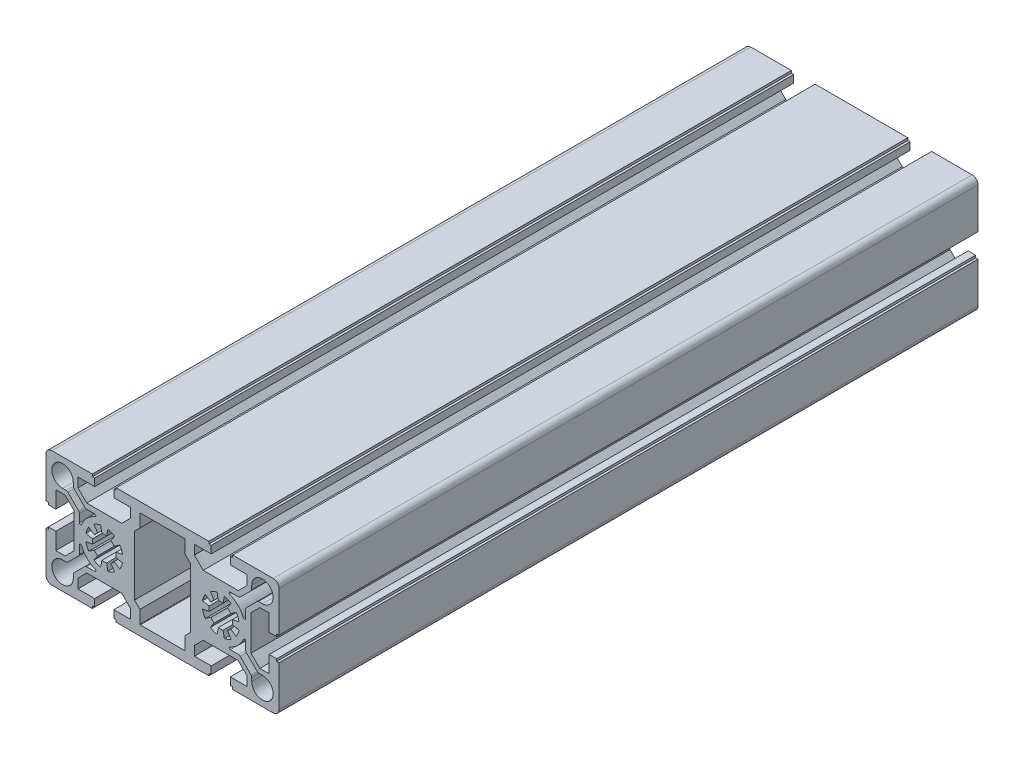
SolidWorks part; units mm, degrees
ref_plane "前视" through (0, 0, 0) normal (0, 0, 1) x (1, 0, 0)
ref_plane "上视" through (0, 0, 0) normal (0, 1, 0) x (1, 0, 0)
ref_plane "右视" through (0, 0, 0) normal (1, 0, 0) x (0, 0, -1)
sketch "Model" plane through (0, 0, 0) normal (0, 0, 1) x (1, 0, 0)
  line L0 (3380.7985, 588.0295) -> (3380.7985, 613.6749)
  line L1 (3380.7985, 613.6749) -> (3378.4985, 615.9749)
  line L2 (3378.4985, 615.9749) -> (3378.4985, 621.4522)
  line L3 (3378.2985, 621.6522) -> (3359.2985, 621.6522)
  line L4 (3359.0985, 621.4522) -> (3359.0985, 615.9749)
  line L5 (3359.0985, 615.9749) -> (3356.7985, 613.6749)
  line L6 (3356.7985, 613.6749) -> (3356.7985, 600.8522)
  line L7 (3356.7985, 600.8522) -> (3356.7985, 588.0295)
  line L8 (3356.7985, 588.0295) -> (3359.0985, 585.7295)
  line L9 (3359.0985, 585.7295) -> (3359.0985, 580.2522)
  line L10 (3359.2985, 580.0522) -> (3378.2985, 580.0522)
  line L11 (3378.4985, 580.2522) -> (3378.4985, 585.7295)
  line L12 (3378.4985, 585.7295) -> (3380.7985, 588.0295)
  line L14 (3330.7913, 585.1939) -> (3335.4567, 589.8593)
  line L15 (3336.1638, 590.1522) -> (3339.6802, 590.1522)
  line L16 (3333.0985, 596.7339) -> (3333.0985, 593.2044)
  line L17 (3332.8056, 592.4973) -> (3328.1533, 587.8451)
  line L18 (3327.4462, 587.5522) -> (3325.8985, 587.5522)
  line L19 (3330.4985, 582.9522) -> (3330.4985, 584.4868)
  line L20 (3339.3539, 607.5039) -> (3340.965, 605.0927)
  line L21 (3339.558, 603.6856) -> (3337.1467, 605.2967)
  line L22 (3335.9522, 602.4129) -> (3338.7964, 601.8471)
  line L23 (3338.7964, 599.8572) -> (3335.9522, 599.2914)
  line L24 (3337.1467, 596.4076) -> (3339.558, 598.0188)
  line L25 (3340.965, 596.6117) -> (3339.3539, 594.2004)
  line L26 (3342.2377, 593.0059) -> (3342.8035, 595.8502)
  line L27 (3344.7934, 595.8502) -> (3345.3592, 593.0059)
  line L28 (3348.243, 594.2004) -> (3346.6319, 596.6117)
  line L29 (3348.0389, 598.0188) -> (3350.4502, 596.4076)
  line L30 (3351.6447, 599.2914) -> (3348.8005, 599.8572)
  line L31 (3348.8005, 601.8471) -> (3351.6447, 602.4129)
  line L32 (3350.4502, 605.2967) -> (3348.0389, 603.6856)
  line L33 (3346.6319, 605.0927) -> (3348.243, 607.5039)
  line L34 (3345.3592, 608.6984) -> (3344.7934, 605.8542)
  line L35 (3342.8035, 605.8542) -> (3342.2377, 608.6984)
  line L36 (3396.6319, 605.0927) -> (3398.243, 607.5039)
  line L37 (3395.3592, 608.6984) -> (3394.7934, 605.8542)
  line L38 (3392.8035, 605.8542) -> (3392.2377, 608.6984)
  line L39 (3389.3539, 607.5039) -> (3390.965, 605.0927)
  line L40 (3389.558, 603.6856) -> (3387.1467, 605.2967)
  line L41 (3385.9522, 602.4129) -> (3388.7964, 601.8471)
  line L42 (3388.7964, 599.8572) -> (3385.9522, 599.2914)
  line L43 (3387.1467, 596.4076) -> (3389.558, 598.0188)
  line L44 (3390.965, 596.6117) -> (3389.3539, 594.2004)
  line L45 (3392.2377, 593.0059) -> (3392.8035, 595.8502)
  line L46 (3394.7934, 595.8502) -> (3395.3592, 593.0059)
  line L47 (3398.243, 594.2004) -> (3396.6319, 596.6117)
  line L48 (3398.0389, 598.0188) -> (3400.4502, 596.4076)
  line L49 (3401.6447, 599.2914) -> (3398.8005, 599.8572)
  line L50 (3398.8005, 601.8471) -> (3401.6447, 602.4129)
  line L51 (3400.4502, 605.2967) -> (3398.0389, 603.6856)
  line L52 (3406.8056, 616.5104) -> (3402.1402, 611.8451)
  line L53 (3401.4331, 611.5522) -> (3397.9167, 611.5522)
  line L54 (3404.4985, 604.9704) -> (3404.4985, 608.4999)
  line L55 (3404.7913, 609.207) -> (3409.4436, 613.8593)
  line L56 (3410.1507, 614.1522) -> (3411.6985, 614.1522)
  line L57 (3407.0985, 618.7522) -> (3407.0985, 617.2175)
  line L58 (3407.0985, 584.4868) -> (3407.0985, 582.9522)
  line L59 (3411.6985, 587.5522) -> (3410.1507, 587.5522)
  line L60 (3409.4436, 587.8451) -> (3404.7913, 592.4973)
  line L61 (3404.4985, 593.2044) -> (3404.4985, 596.7339)
  line L62 (3397.9167, 590.1522) -> (3401.4331, 590.1522)
  line L63 (3402.1402, 589.8593) -> (3406.8056, 585.1939)
  line L64 (3348.8985, 576.8522) -> (3348.8985, 575.8522)
  line L65 (3348.8985, 575.8522) -> (3368.7985, 575.8522)
  line L66 (3368.7985, 575.8522) -> (3388.6985, 575.8522)
  line L67 (3388.6985, 575.8522) -> (3388.6985, 576.8522)
  line L68 (3388.6985, 576.8522) -> (3389.6985, 576.8522)
  line L69 (3389.6985, 576.8522) -> (3389.6985, 580.0522)
  line L70 (3389.6985, 580.0522) -> (3382.4985, 580.0522)
  line L71 (3382.4985, 580.0522) -> (3382.4985, 584.0726)
  line L72 (3382.4985, 584.0726) -> (3386.278, 587.8522)
  line L73 (3386.278, 587.8522) -> (3393.7985, 587.8522)
  line L74 (3393.7985, 587.8522) -> (3401.3189, 587.8522)
  line L75 (3401.3189, 587.8522) -> (3405.0985, 584.0726)
  line L76 (3405.0985, 584.0726) -> (3405.0985, 580.0522)
  line L77 (3405.0985, 580.0522) -> (3397.8985, 580.0522)
  line L78 (3397.8985, 580.0522) -> (3397.8985, 576.8522)
  line L79 (3397.8985, 576.8522) -> (3398.8985, 576.8522)
  line L80 (3398.8985, 576.8522) -> (3398.8985, 575.8522)
  line L81 (3398.8985, 575.8522) -> (3416.2985, 575.8522)
  line L82 (3418.7985, 578.3522) -> (3418.7985, 595.7522)
  line L83 (3418.7985, 595.7522) -> (3417.7985, 595.7522)
  line L84 (3417.7985, 595.7522) -> (3417.7985, 596.7522)
  line L85 (3417.7985, 596.7522) -> (3414.5985, 596.7522)
  line L86 (3414.5985, 596.7522) -> (3414.5985, 589.5522)
  line L87 (3414.5985, 589.5522) -> (3410.5649, 589.5522)
  line L88 (3410.5649, 589.5522) -> (3406.7985, 593.3186)
  line L89 (3406.7985, 593.3186) -> (3406.7985, 600.8522)
  line L90 (3406.7985, 600.8522) -> (3406.7985, 608.3857)
  line L91 (3406.7985, 608.3857) -> (3410.5649, 612.1522)
  line L92 (3410.5649, 612.1522) -> (3414.5985, 612.1522)
  line L93 (3414.5985, 612.1522) -> (3414.5985, 604.9522)
  line L94 (3414.5985, 604.9522) -> (3417.7985, 604.9522)
  line L95 (3417.7985, 604.9522) -> (3417.7985, 605.9522)
  line L96 (3417.7985, 605.9522) -> (3418.7985, 605.9522)
  line L97 (3418.7985, 605.9522) -> (3418.7985, 623.3522)
  line L98 (3416.2985, 625.8522) -> (3398.8985, 625.8522)
  line L99 (3398.8985, 625.8522) -> (3398.8985, 624.8522)
  line L100 (3398.8985, 624.8522) -> (3397.8985, 624.8522)
  line L101 (3397.8985, 624.8522) -> (3397.8985, 621.6522)
  line L102 (3397.8985, 621.6522) -> (3405.0985, 621.6522)
  line L103 (3405.0985, 621.6522) -> (3405.0985, 617.6317)
  line L104 (3405.0985, 617.6317) -> (3401.3189, 613.8522)
  line L105 (3401.3189, 613.8522) -> (3393.7985, 613.8522)
  line L106 (3393.7985, 613.8522) -> (3386.278, 613.8522)
  line L107 (3386.278, 613.8522) -> (3382.4985, 617.6317)
  line L108 (3382.4985, 617.6317) -> (3382.4985, 621.6522)
  line L109 (3382.4985, 621.6522) -> (3389.6985, 621.6522)
  line L110 (3389.6985, 621.6522) -> (3389.6985, 624.8522)
  line L111 (3389.6985, 624.8522) -> (3388.6985, 624.8522)
  line L112 (3388.6985, 624.8522) -> (3388.6985, 625.8522)
  line L113 (3388.6985, 625.8522) -> (3368.7985, 625.8522)
  line L114 (3368.7985, 625.8522) -> (3348.8985, 625.8522)
  line L115 (3348.8985, 625.8522) -> (3348.8985, 624.8522)
  line L116 (3348.8985, 624.8522) -> (3347.8985, 624.8522)
  line L117 (3347.8985, 624.8522) -> (3347.8985, 621.6522)
  line L118 (3347.8985, 621.6522) -> (3355.0985, 621.6522)
  line L119 (3355.0985, 621.6522) -> (3355.0985, 617.6317)
  line L120 (3355.0985, 617.6317) -> (3351.3189, 613.8522)
  line L121 (3351.3189, 613.8522) -> (3343.7985, 613.8522)
  line L122 (3343.7985, 613.8522) -> (3336.278, 613.8522)
  line L123 (3336.278, 613.8522) -> (3332.4985, 617.6317)
  line L124 (3332.4985, 617.6317) -> (3332.4985, 621.6522)
  line L125 (3332.4985, 621.6522) -> (3339.6985, 621.6522)
  line L126 (3339.6985, 621.6522) -> (3339.6985, 624.8522)
  line L127 (3339.6985, 624.8522) -> (3338.6985, 624.8522)
  line L128 (3338.6985, 624.8522) -> (3338.6985, 625.8522)
  line L129 (3338.6985, 625.8522) -> (3321.2985, 625.8522)
  line L130 (3318.7985, 623.3522) -> (3318.7985, 605.9522)
  line L131 (3318.7985, 605.9522) -> (3319.7985, 605.9522)
  line L132 (3319.7985, 605.9522) -> (3319.7985, 604.9522)
  line L133 (3319.7985, 604.9522) -> (3322.9985, 604.9522)
  line L134 (3322.9985, 604.9522) -> (3322.9985, 612.1522)
  line L135 (3322.9985, 612.1522) -> (3327.032, 612.1522)
  line L136 (3327.032, 612.1522) -> (3330.7985, 608.3857)
  line L137 (3330.7985, 608.3857) -> (3330.7985, 600.8522)
  line L138 (3330.7985, 600.8522) -> (3330.7985, 593.3186)
  line L139 (3330.7985, 593.3186) -> (3327.032, 589.5522)
  line L140 (3327.032, 589.5522) -> (3322.9985, 589.5522)
  line L141 (3322.9985, 589.5522) -> (3322.9985, 596.7522)
  line L142 (3322.9985, 596.7522) -> (3319.7985, 596.7522)
  line L143 (3319.7985, 596.7522) -> (3319.7985, 595.7522)
  line L144 (3319.7985, 595.7522) -> (3318.7985, 595.7522)
  line L145 (3318.7985, 595.7522) -> (3318.7985, 578.3522)
  line L146 (3321.2985, 575.8522) -> (3338.6985, 575.8522)
  line L147 (3338.6985, 575.8522) -> (3338.6985, 576.8522)
  line L148 (3338.6985, 576.8522) -> (3339.6985, 576.8522)
  line L149 (3339.6985, 576.8522) -> (3339.6985, 580.0522)
  line L150 (3339.6985, 580.0522) -> (3332.4985, 580.0522)
  line L151 (3332.4985, 580.0522) -> (3332.4985, 584.0726)
  line L152 (3332.4985, 584.0726) -> (3336.278, 587.8522)
  line L153 (3336.278, 587.8522) -> (3343.7985, 587.8522)
  line L154 (3343.7985, 587.8522) -> (3351.3189, 587.8522)
  line L155 (3351.3189, 587.8522) -> (3355.0985, 584.0726)
  line L156 (3355.0985, 584.0726) -> (3355.0985, 580.0522)
  line L157 (3355.0985, 580.0522) -> (3347.8985, 580.0522)
  line L158 (3347.8985, 580.0522) -> (3347.8985, 576.8522)
  line L159 (3347.8985, 576.8522) -> (3348.8985, 576.8522)
  line L160 (3330.4985, 617.2175) -> (3330.4985, 618.7522)
  line L161 (3325.8985, 614.1522) -> (3327.4462, 614.1522)
  line L162 (3328.1533, 613.8593) -> (3332.8056, 609.207)
  line L163 (3333.0985, 608.4999) -> (3333.0985, 604.9704)
  line L164 (3339.6802, 611.5522) -> (3336.1638, 611.5522)
  line L165 (3335.4567, 611.8451) -> (3330.7913, 616.5104)
  arc A0 (3378.4985, 621.4522) -> (3378.2985, 621.6522) centre (3378.2985, 621.4522) ccw
  arc A1 (3359.2985, 621.6522) -> (3359.0985, 621.4522) centre (3359.2985, 621.4522) ccw
  arc A2 (3359.0985, 580.2522) -> (3359.2985, 580.0522) centre (3359.2985, 580.2522) ccw
  arc A3 (3378.2985, 580.0522) -> (3378.4985, 580.2522) centre (3378.2985, 580.2522) ccw
  arc A4 (3330.7913, 585.1939) -> (3330.4985, 584.4868) centre (3331.4985, 584.4868) ccw
  arc A5 (3336.1638, 590.1522) -> (3335.4567, 589.8593) centre (3336.1638, 589.1522) ccw
  arc A6 (3339.6802, 590.1522) -> (3339.8674, 591.1158) centre (3339.6802, 590.6522) ccw
  arc A7 (3334.0621, 596.9211) -> (3339.8674, 591.1158) centre (3343.7985, 600.8522) ccw
  arc A8 (3334.0621, 596.9211) -> (3333.0985, 596.7339) centre (3333.5985, 596.7339) ccw
  arc A9 (3332.8056, 592.4973) -> (3333.0985, 593.2044) centre (3332.0985, 593.2044) ccw
  arc A10 (3327.4462, 587.5522) -> (3328.1533, 587.8451) centre (3327.4462, 588.5522) ccw
  arc A11 (3325.8985, 587.5522) -> (3330.4985, 582.9522) centre (3325.8985, 582.9522) ccw
  arc A12 (3340.965, 605.0927) -> (3339.558, 603.6856) centre (3343.7985, 600.8522) ccw
  arc A13 (3337.1467, 605.2967) -> (3335.9522, 602.4129) centre (3343.7985, 600.8522) ccw
  arc A14 (3338.7964, 601.8471) -> (3338.7964, 599.8572) centre (3343.7985, 600.8522) ccw
  arc A15 (3335.9522, 599.2914) -> (3337.1467, 596.4076) centre (3343.7985, 600.8522) ccw
  arc A16 (3339.558, 598.0188) -> (3340.965, 596.6117) centre (3343.7985, 600.8522) ccw
  arc A17 (3339.3539, 594.2004) -> (3342.2377, 593.0059) centre (3343.7985, 600.8522) ccw
  arc A18 (3342.8035, 595.8502) -> (3344.7934, 595.8502) centre (3343.7985, 600.8522) ccw
  arc A19 (3345.3592, 593.0059) -> (3348.243, 594.2004) centre (3343.7985, 600.8522) ccw
  arc A20 (3346.6319, 596.6117) -> (3348.0389, 598.0188) centre (3343.7985, 600.8522) ccw
  arc A21 (3350.4502, 596.4076) -> (3351.6447, 599.2914) centre (3343.7985, 600.8522) ccw
  arc A22 (3348.8005, 599.8572) -> (3348.8005, 601.8471) centre (3343.7985, 600.8522) ccw
  arc A23 (3351.6447, 602.4129) -> (3350.4502, 605.2967) centre (3343.7985, 600.8522) ccw
  arc A24 (3348.0389, 603.6856) -> (3346.6319, 605.0927) centre (3343.7985, 600.8522) ccw
  arc A25 (3348.243, 607.5039) -> (3345.3592, 608.6984) centre (3343.7985, 600.8522) ccw
  arc A26 (3344.7934, 605.8542) -> (3342.8035, 605.8542) centre (3343.7985, 600.8522) ccw
  arc A27 (3342.2377, 608.6984) -> (3339.3539, 607.5039) centre (3343.7985, 600.8522) ccw
  arc A28 (3398.243, 607.5039) -> (3395.3592, 608.6984) centre (3393.7985, 600.8522) ccw
  arc A29 (3394.7934, 605.8542) -> (3392.8035, 605.8542) centre (3393.7985, 600.8522) ccw
  arc A30 (3392.2377, 608.6984) -> (3389.3539, 607.5039) centre (3393.7985, 600.8522) ccw
  arc A31 (3390.965, 605.0927) -> (3389.558, 603.6856) centre (3393.7985, 600.8522) ccw
  arc A32 (3387.1467, 605.2967) -> (3385.9522, 602.4129) centre (3393.7985, 600.8522) ccw
  arc A33 (3388.7964, 601.8471) -> (3388.7964, 599.8572) centre (3393.7985, 600.8522) ccw
  arc A34 (3385.9522, 599.2914) -> (3387.1467, 596.4076) centre (3393.7985, 600.8522) ccw
  arc A35 (3389.558, 598.0188) -> (3390.965, 596.6117) centre (3393.7985, 600.8522) ccw
  arc A36 (3389.3539, 594.2004) -> (3392.2377, 593.0059) centre (3393.7985, 600.8522) ccw
  arc A37 (3392.8035, 595.8502) -> (3394.7934, 595.8502) centre (3393.7985, 600.8522) ccw
  arc A38 (3395.3592, 593.0059) -> (3398.243, 594.2004) centre (3393.7985, 600.8522) ccw
  arc A39 (3396.6319, 596.6117) -> (3398.0389, 598.0188) centre (3393.7985, 600.8522) ccw
  arc A40 (3400.4502, 596.4076) -> (3401.6447, 599.2914) centre (3393.7985, 600.8522) ccw
  arc A41 (3398.8005, 599.8572) -> (3398.8005, 601.8471) centre (3393.7985, 600.8522) ccw
  arc A42 (3401.6447, 602.4129) -> (3400.4502, 605.2967) centre (3393.7985, 600.8522) ccw
  arc A43 (3398.0389, 603.6856) -> (3396.6319, 605.0927) centre (3393.7985, 600.8522) ccw
  arc A44 (3406.8056, 616.5104) -> (3407.0985, 617.2175) centre (3406.0985, 617.2175) ccw
  arc A45 (3401.4331, 611.5522) -> (3402.1402, 611.8451) centre (3401.4331, 612.5522) ccw
  arc A46 (3397.9167, 611.5522) -> (3397.7295, 610.5885) centre (3397.9167, 611.0522) ccw
  arc A47 (3403.5348, 604.7832) -> (3397.7295, 610.5885) centre (3393.7985, 600.8522) ccw
  arc A48 (3403.5348, 604.7832) -> (3404.4985, 604.9704) centre (3403.9985, 604.9704) ccw
  arc A49 (3404.7913, 609.207) -> (3404.4985, 608.4999) centre (3405.4985, 608.4999) ccw
  arc A50 (3410.1507, 614.1522) -> (3409.4436, 613.8593) centre (3410.1507, 613.1522) ccw
  arc A51 (3411.6985, 614.1522) -> (3407.0985, 618.7522) centre (3411.6985, 618.7522) ccw
  arc A52 (3407.0985, 584.4868) -> (3406.8056, 585.1939) centre (3406.0985, 584.4868) ccw
  arc A53 (3407.0985, 582.9522) -> (3411.6985, 587.5522) centre (3411.6985, 582.9522) ccw
  arc A54 (3409.4436, 587.8451) -> (3410.1507, 587.5522) centre (3410.1507, 588.5522) ccw
  arc A55 (3404.4985, 593.2044) -> (3404.7913, 592.4973) centre (3405.4985, 593.2044) ccw
  arc A56 (3404.4985, 596.7339) -> (3403.5348, 596.9211) centre (3403.9985, 596.7339) ccw
  arc A57 (3397.7295, 591.1158) -> (3403.5348, 596.9211) centre (3393.7985, 600.8522) ccw
  arc A58 (3397.7295, 591.1158) -> (3397.9167, 590.1522) centre (3397.9167, 590.6522) ccw
  arc A59 (3402.1402, 589.8593) -> (3401.4331, 590.1522) centre (3401.4331, 589.1522) ccw
  arc A60 (3416.2985, 575.8522) -> (3418.7985, 578.3522) centre (3416.2985, 578.3522) ccw
  arc A61 (3418.7985, 623.3522) -> (3416.2985, 625.8522) centre (3416.2985, 623.3522) ccw
  arc A62 (3321.2985, 625.8522) -> (3318.7985, 623.3522) centre (3321.2985, 623.3522) ccw
  arc A63 (3318.7985, 578.3522) -> (3321.2985, 575.8522) centre (3321.2985, 578.3522) ccw
  arc A64 (3330.4985, 617.2175) -> (3330.7913, 616.5104) centre (3331.4985, 617.2175) ccw
  arc A65 (3330.4985, 618.7522) -> (3325.8985, 614.1522) centre (3325.8985, 618.7522) ccw
  arc A66 (3328.1533, 613.8593) -> (3327.4462, 614.1522) centre (3327.4462, 613.1522) ccw
  arc A67 (3333.0985, 608.4999) -> (3332.8056, 609.207) centre (3332.0985, 608.4999) ccw
  arc A68 (3333.0985, 604.9704) -> (3334.0621, 604.7832) centre (3333.5985, 604.9704) ccw
  arc A69 (3339.8674, 610.5885) -> (3334.0621, 604.7832) centre (3343.7985, 600.8522) ccw
  arc A70 (3339.8674, 610.5885) -> (3339.6802, 611.5522) centre (3339.6802, 611.0522) ccw
  arc A71 (3335.4567, 611.8451) -> (3336.1638, 611.5522) centre (3336.1638, 612.5522) ccw
extrude "凸台-拉伸1" add sketch "Model" along normal blind 300
